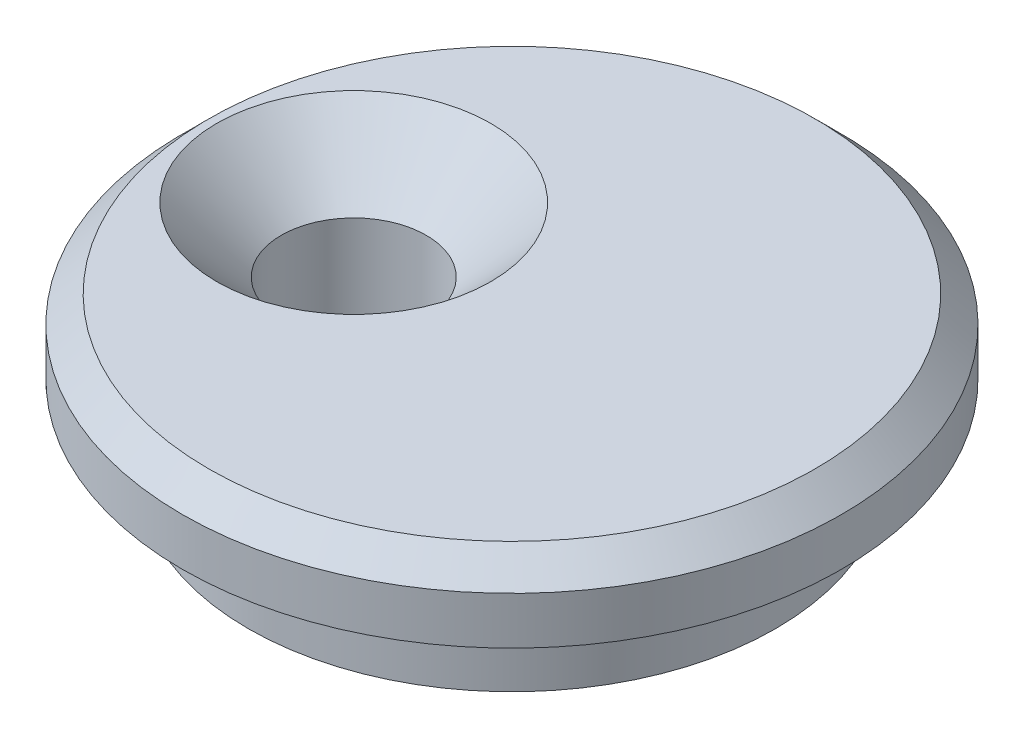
SolidWorks part; units mm, degrees
ref_plane "Front Plane" through (0, 0, 0) normal (0, 0, 1) x (1, 0, 0)
ref_plane "Top Plane" through (0, 0, 0) normal (0, 1, 0) x (1, 0, 0)
ref_plane "Right Plane" through (0, 0, 0) normal (1, 0, 0) x (0, 0, -1)
sketch "Sketch1" plane through (0, 0, 0) normal (0, 1, 0) x (1, 0, 0)
  circle A0 centre (0, 0) radius 12.5
  dimension "D1" = 25
extrude "Extrude1" add sketch "Sketch1" against normal blind 2.8
chamfer "Chamfer1" distance 1 angle 45 1 edges at (0, 0, 12.5)
sketch "Sketch2" plane through (0, -2.8, 0) normal (0, -1, 0) x (1, 0, 0)
  circle A0 centre (0, 0) radius 10
  dimension "D1" = 20
extrude "Extrude2" add sketch "Sketch2" along normal blind 3.2
sketch "Sketch3" plane through (0, 0, 0) normal (0, 1, 0) x (1, 0, 0)
  line L0 (0, 0) -> (-12.5, 0) construction
  circle A0 centre (0, 0) radius 12.5 construction
  point P6 (-6, 0)
  dimension "D1" = 6
hole_wizard "CSK for M5 Countersunk Flat Head Screw1" positions "3DSketch1" profile "Sketch4" countersink size "M5" standard "ISO"
sketch3d "3DSketch1"
  point P0 (-6, 0, 0)
sketch "Sketch4" plane through (-6, 0, 0) normal (1, 0, 0) x (0, 0, 1)
  line L0 (0, 0) -> (0, 6)
  line L1 (0, 6) -> (2.75, 6)
  line L2 (2.75, 6) -> (2.75, 2.45)
  line L3 (2.75, 2.45) -> (5.2, 0)
  line L5 (5.2, 0) -> (0, 0)
  line L6 (-2.75, 2.45) -> (-5.2, 0) construction
  line L11 (0, -6.35) -> (0, 107.95) construction
  dimension "Thru Hole Dia." = 5.5
  dimension "Thru Hole Depth" = 6
  dimension "Near C'Sink Dia." = 10.4
  dimension "Near C'Sink Angle" = 90
